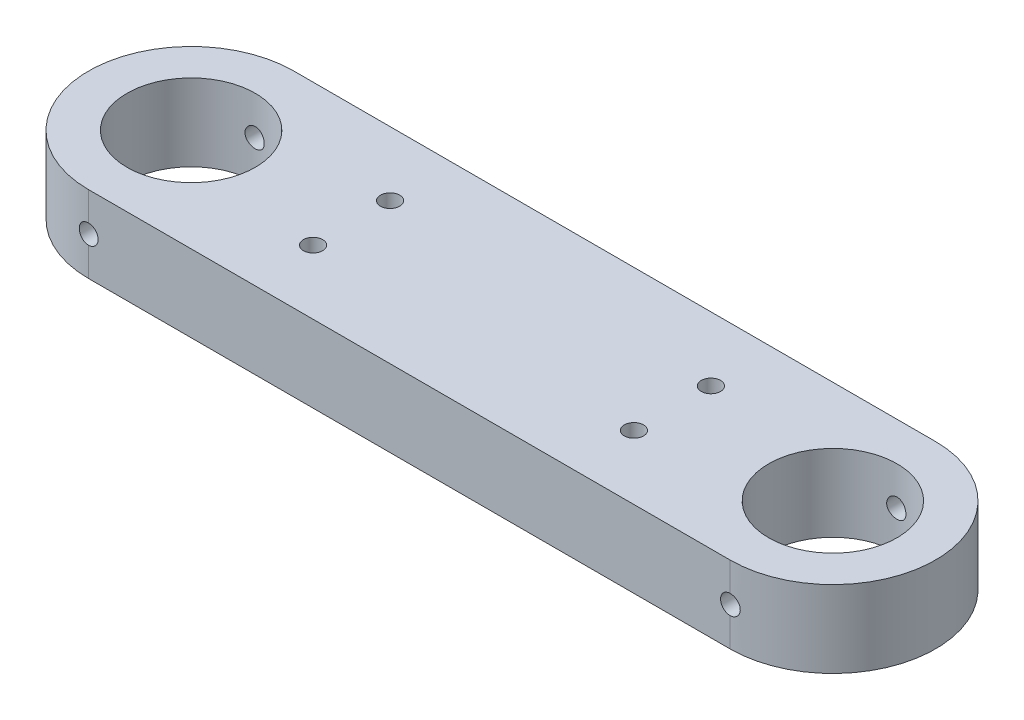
SolidWorks part; units mm, degrees
ref_plane "Front Plane" through (0, 0, 0) normal (0, 0, 1) x (1, 0, 0)
ref_plane "Top Plane" through (0, 0, 0) normal (0, 1, 0) x (1, 0, 0)
ref_plane "Right Plane" through (0, 0, 0) normal (1, 0, 0) x (0, 0, -1)
sketch "Sketch1" plane through (0, 0, 0) normal (0, 1, 0) x (1, 0, 0)
  line L1 (-158.75, 50.8) -> (158.75, 50.8)
  line L3 (-158.75, -50.8) -> (158.75, -50.8)
  arc A0 (158.75, 50.8) -> (158.75, -50.8) centre (158.75, 0) cw
  arc A1 (-158.75, 50.8) -> (-158.75, -50.8) centre (-158.75, 0) ccw
  circle A2 centre (-158.75, 0) radius 31.75
  circle A3 centre (158.75, 0) radius 31.75
  circle A4 centre (-79.375, 19.05) radius 4.7625
  circle A5 centre (79.375, 19.05) radius 4.7625
  circle A6 centre (-79.375, -19.05) radius 4.7625
  circle A7 centre (79.375, -19.05) radius 4.7625
  dimension "D3" = 317.5
  dimension "D5" = 79.375
  dimension "D6" = 31.75
  dimension "D7" = 158.75
  dimension "D8" = 158.75
  dimension "D9" = 38.1
  dimension "D10" = 38.1
  dimension "D1" = 101.6
  dimension "D2" = 50.8
  dimension "D4" = 158.75
extrude "Extrude1" add sketch "Sketch1" against normal blind 38.1
sketch "Sketch2" plane through (0, 0, 0) normal (0, 0, 1) x (1, 0, 0)
  line L0 (-158.75, -38.1) -> (-158.75, 0) construction
  circle A0 centre (-158.75, -19.05) radius 4.7625
extrude "Cut-Extrude1" cut sketch "Sketch2" against normal mid plane 104.14
mirror "Mirror1" about plane through (0, 0, 0) normal (1, 0, 0) of "Cut-Extrude1"
